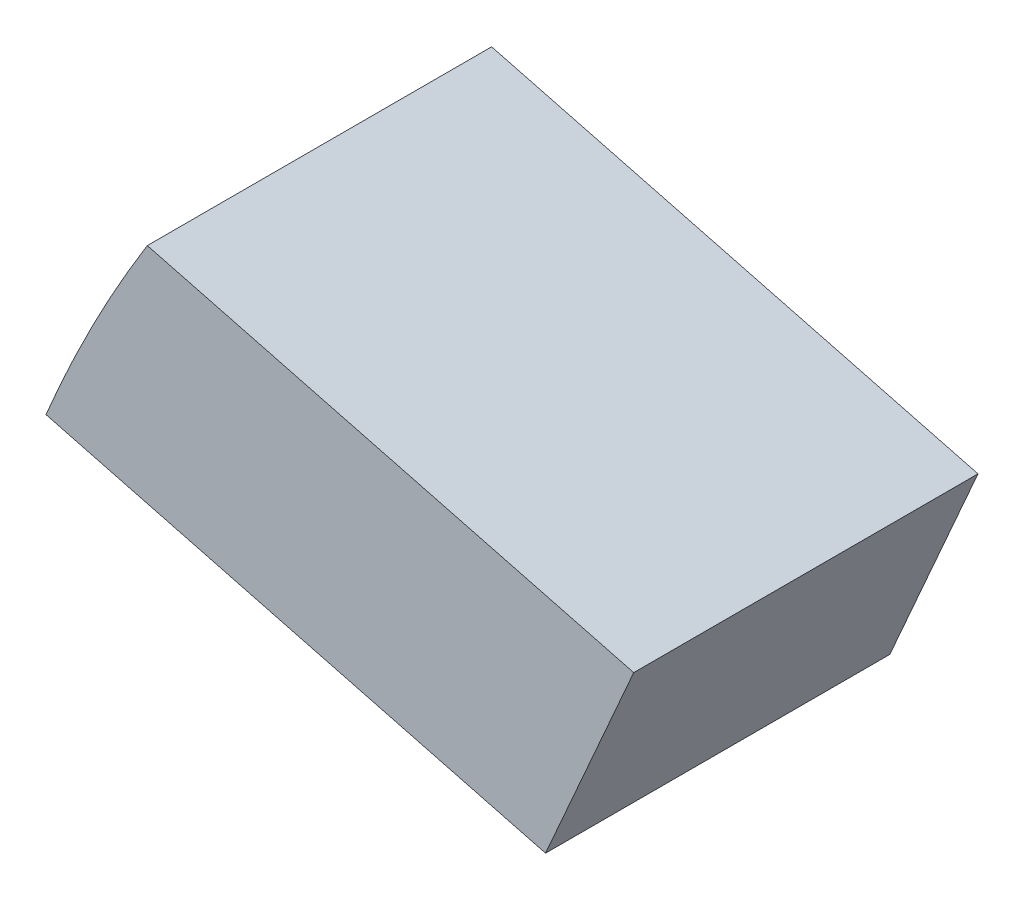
SolidWorks part; units mm, degrees
ref_plane "Front Plane" through (0, 0, 0) normal (0, 0, 1) x (1, 0, 0)
ref_plane "Top Plane" through (0, 0, 0) normal (0, 1, 0) x (1, 0, 0)
ref_plane "Right Plane" through (0, 0, 0) normal (1, 0, 0) x (0, 0, -1)
sketch "Sketch1" plane through (0, 0, 0) normal (0, 0, 1) x (1, 0, 0)
  line L0 (0, 0) -> (-6.7481, 24.4872) construction
  line L1 (0, 0) -> (17.8325, 18.0876) construction
  line L2 (0, 0) -> (24.5806, -6.3996) construction
  line L3 (0, 0) -> (6.7481, -24.4872) construction
  line L4 (0, 0) -> (-17.8325, -18.0876) construction
  line L5 (0, 0) -> (-24.5806, 6.3996) construction
  line L6 (-5.0611, 18.3654) -> (-5.9035, 21.4224) construction
  line L7 (13.3744, 13.5657) -> (15.6006, 15.8238) construction
  line L8 (18.4354, -4.7997) -> (21.5041, -5.5986) construction
  line L9 (5.0611, -18.3654) -> (5.9035, -21.4224) construction
  line L10 (-13.3744, -13.5657) -> (-15.6006, -15.8238) construction
  line L11 (-18.4354, 4.7997) -> (-21.5041, 5.5986) construction
  line L12 (-19.635, 9.2333) -> (7.6902, 2.1192) construction
  line L13 (-1.8212, 21.6211) -> (5.6804, -5.6003) construction
  line L14 (17.8138, 12.3877) -> (-2.0098, -7.7195) construction
  line L15 (19.635, -9.2333) -> (-7.6902, -2.1192) construction
  line L16 (1.8212, -21.6211) -> (-5.6804, 5.6003) construction
  line L17 (-17.8138, -12.3877) -> (2.0098, 7.7195) construction
  line L18 (-5.6804, 5.6003) -> (-7.6902, -2.1192) construction
  line L19 (-7.6902, -2.1192) -> (-2.0098, -7.7195) construction
  line L20 (-2.0098, -7.7195) -> (5.6804, -5.6003) construction
  line L21 (5.6804, -5.6003) -> (7.6902, 2.1192) construction
  line L22 (7.6902, 2.1192) -> (2.0098, 7.7195) construction
  line L23 (2.0098, 7.7195) -> (-5.6804, 5.6003) construction
  line L24 (-10.6636, 6.8976) -> (-12.2903, 3.1998)
  line L25 (-12.2903, 3.1998) -> (-21.5041, 5.5986)
  line L26 (-19.635, 9.2333) -> (-10.6636, 6.8976)
  circle A0 centre (0, 0) radius 25.4 construction
  circle A1 centre (0, 0) radius 19.05 construction
  circle A2 centre (0, 0) radius 22.221 construction
  circle A3 centre (0, 0) radius 12.7 construction
  spline S0 degree 2 poles (-5.9035, 21.4224) (6.1634, 22.9446) (13.3744, 13.5657) knots 0 0 0 1 1 1 construction
  spline S1 degree 2 poles (15.6006, 15.8238) (22.9523, 6.1346) (18.4354, -4.7997) knots 0 0 0 1 1 1 construction
  spline S2 degree 2 poles (21.5041, -5.5986) (16.7889, -16.81) (5.0611, -18.3654) knots 0 0 0 1 1 1 construction
  spline S3 degree 2 poles (5.9035, -21.4224) (-6.1634, -22.9446) (-13.3744, -13.5657) knots 0 0 0 1 1 1 construction
  spline S4 degree 2 poles (-15.6006, -15.8238) (-22.9523, -6.1346) (-18.4354, 4.7997) knots 0 0 0 1 1 1 construction
  spline S5 degree 2 poles (-21.5041, 5.5986) (-16.7889, 16.81) (-5.0611, 18.3654) knots 0 0 0 1 1 1 construction
  spline S6 degree 2 poles (-21.5041, 5.5986) (-20.7154, 7.4917) (-19.635, 9.2333) knots 0 0 0 1 1 1 construction
  spline S7 degree 2 poles (-19.635, 9.2333) (-20.7154, 7.4917) (-21.5041, 5.5986) knots 0 0 0 1 1 1
  dimension "D1" = 6
  dimension "D2" = 6
  dimension "D3" = 6.35
extrude "Boss-Extrude1" add sketch "Sketch1" along normal blind 6.35
